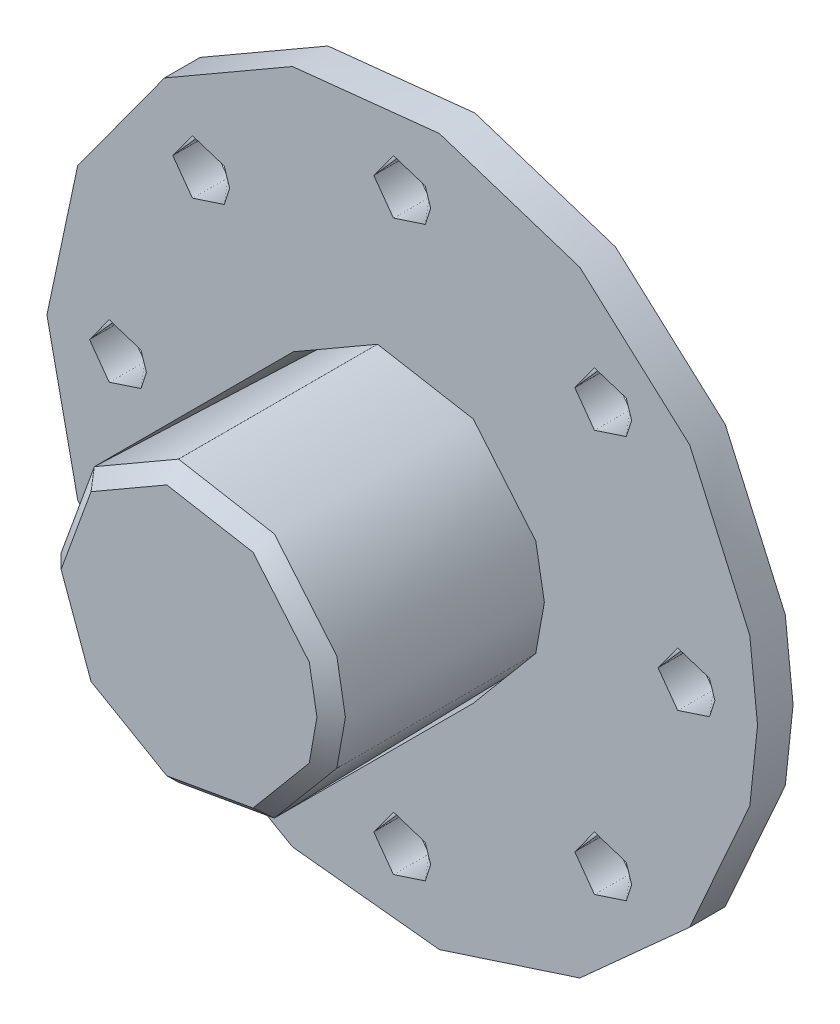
SolidWorks part; units mm, degrees
ref_plane "Plan de face" through (0, 0, 0) normal (0, 0, 1) x (1, 0, 0)
ref_plane "Plan de dessus" through (0, 0, 0) normal (0, 1, 0) x (1, 0, 0)
ref_plane "Plan de droite" through (0, 0, 0) normal (1, 0, 0) x (0, 0, -1)
sketch "Esquisse1" plane through (0, 0, 0) normal (0, 0, 1) x (1, 0, 0)
  circle A0 centre (0, 0) radius 50
  circle A1 centre (0, 0) radius 40 construction
  circle A2 centre (0, 40) radius 4
  circle A3 centre (28.2843, 28.2843) radius 4
  circle A4 centre (40, 0) radius 4
  circle A5 centre (28.2843, -28.2843) radius 4
  circle A6 centre (0, -40) radius 4
  circle A7 centre (-28.2843, -28.2843) radius 4
  circle A8 centre (-40, 0) radius 4
  circle A9 centre (-28.2843, 28.2843) radius 4
  dimension "D1" = 100
  dimension "D2" = 80
  dimension "D3" = 8
  dimension "D4" = 8
extrude "Boss.-Extru.1" add sketch "Esquisse1" along normal blind 5
sketch "Esquisse2" plane through (0, 0, 5) normal (0, 0, 1) x (1, 0, 0)
  circle A0 centre (0, 0) radius 20
  dimension "D1" = 40
extrude "Boss.-Extru.2" add sketch "Esquisse2" along normal blind 30
chamfer "Chanfrein1" distance 2 angle 45 1 edges at (20, 0, 35)
